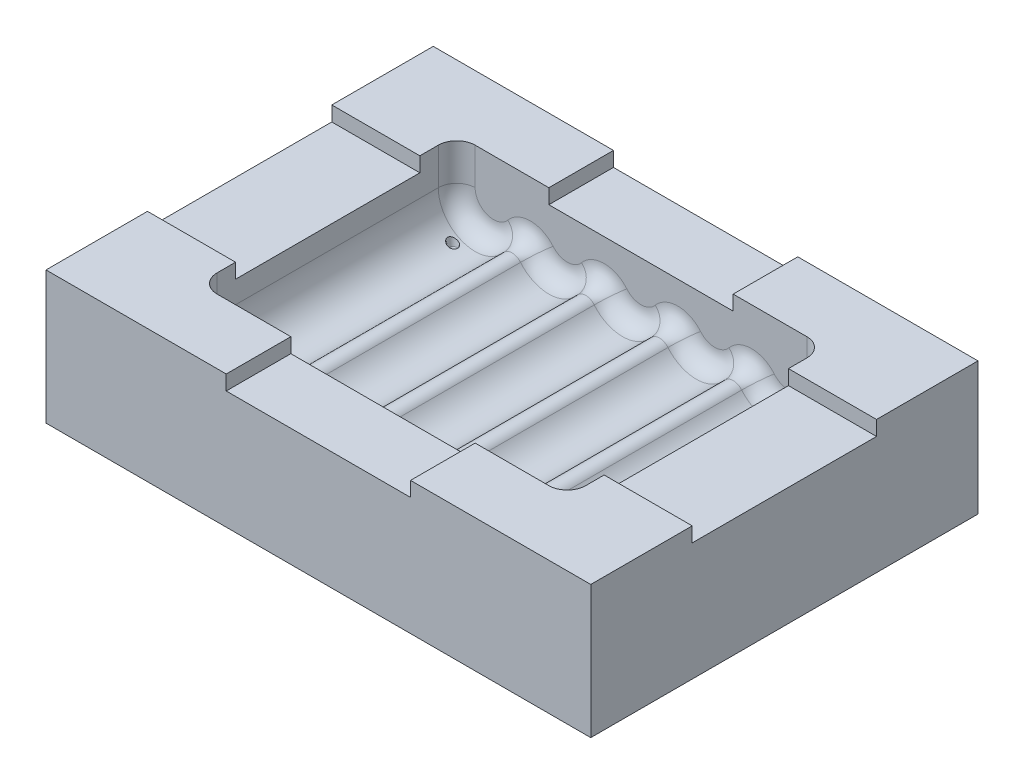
SolidWorks part; units mm, degrees
ref_plane "Front Plane" through (0, 0, 0) normal (0, 0, 1) x (1, 0, 0)
ref_plane "Top Plane" through (0, 0, 0) normal (0, 1, 0) x (1, 0, 0)
ref_plane "Right Plane" through (0, 0, 0) normal (1, 0, 0) x (0, 0, -1)
surface "Surface-Radiate1" parameters "D1"=20
surface "Surface-Knit1"
ref_plane "Plane1" through (0, -18, 0) normal (0, 1, 0) x (1, 0, 0)
sketch "Sketch2" plane through (0, -18, 0) normal (0, 1, 0) x (1, 0, 0)
  line L1 (36.9482, 26.2644) -> (-36.9482, 26.2644)
  line L2 (36.9482, 26.2644) -> (36.9482, -26.2644)
  line L3 (36.9482, -26.2644) -> (-36.9482, -26.2644)
  line L4 (-36.9482, 26.2644) -> (-36.9482, -26.2644)
  line L5 (36.9482, 26.2644) -> (-36.9482, -26.2644) construction
  line L6 (36.9482, -26.2644) -> (-36.9482, 26.2644) construction
  point P0 (0, 0)
  point P6 (-32.7698, -33.3619)
  point P7 (-36.9482, -26.2644)
extrude "Boss-Extrude2" add sketch "Sketch2" along normal up to surface (18 mm away)
